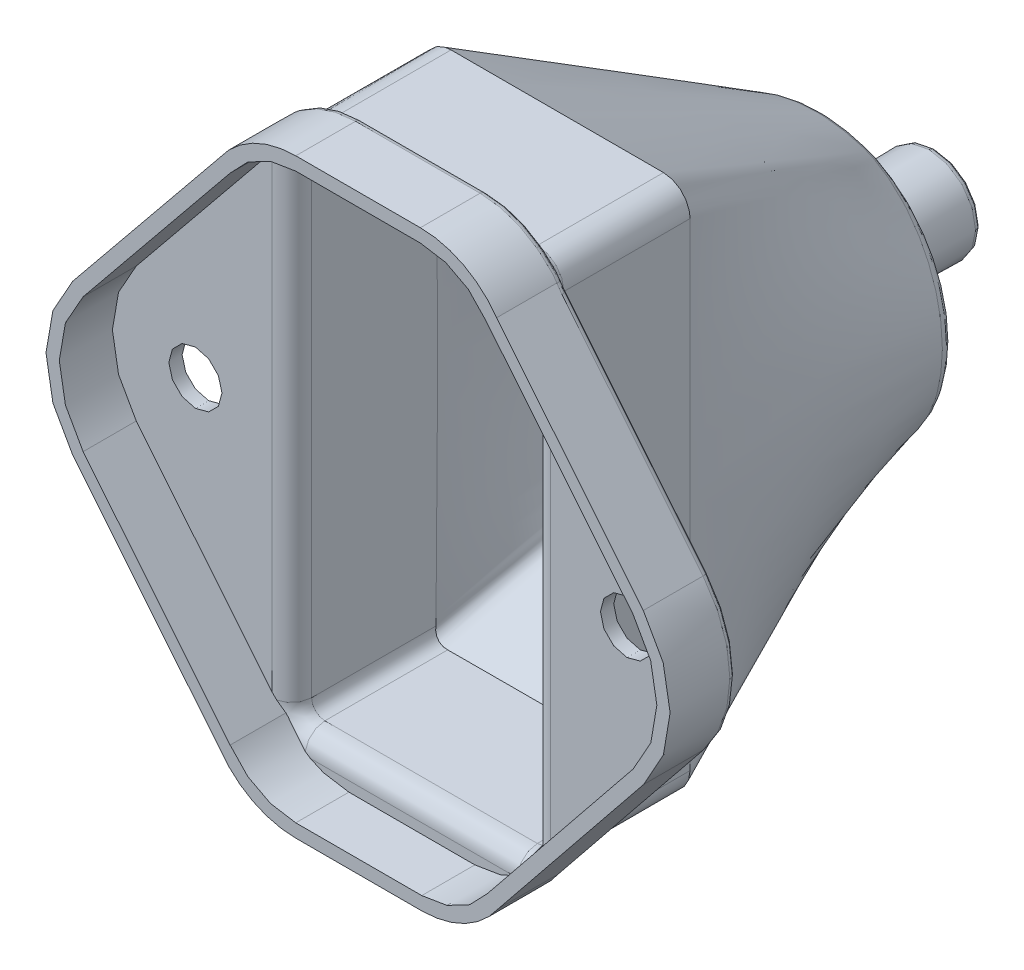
SolidWorks part; units mm, degrees
ref_plane "Plan de face" through (0, 0, 0) normal (0, 0, 1) x (1, 0, 0)
ref_plane "Plan de dessus" through (0, 0, 0) normal (0, 1, 0) x (1, 0, 0)
ref_plane "Plan de droite" through (0, 0, 0) normal (1, 0, 0) x (0, 0, -1)
sketch "Esquisse1" plane through (0, 0, 0) normal (0, 0, 1) x (1, 0, 0)
  line L0 (-69.4038, 0) -> (68.4211, 0) construction
  line L1 (0, 58.9625) -> (0, -57.9798) construction
  line L2 (-9.3809, 44.5) -> (9.3809, 44.5)
  line L3 (21.0814, -38.5) -> (43.0129, -11.2977)
  line L4 (20.87, 38.5) -> (42.9597, 11.3634)
  line L5 (9.5923, -44.5) -> (-9.3809, -44.5)
  line L6 (-20.87, -38.5) -> (-42.9597, -11.3634)
  line L7 (-20.87, 38.5) -> (-42.9597, 11.3634)
  line L8 (47, 0) -> (47, 40.5367) construction
  line L9 (-47, 0) -> (-47, 38.6875) construction
  arc A0 (20.87, 38.5) -> (9.3809, 44.5) centre (9.3809, 30.5) ccw
  arc A1 (-20.87, 38.5) -> (-9.3809, 44.5) centre (-9.3809, 30.5) cw
  arc A2 (-9.3809, -44.5) -> (-20.87, -38.5) centre (-9.3809, -30.5) cw
  arc A3 (21.0814, -38.5) -> (9.5923, -44.5) centre (9.5923, -30.5) cw
  arc A4 (43.0129, -11.2977) -> (42.9597, 11.3634) centre (29, 0) ccw
  arc A5 (-42.9597, 11.3634) -> (-42.9597, -11.3634) centre (-29, 0) ccw
  point P14 (16.934, 45)
  point P17 (-16.934, 45)
  point P20 (-16.934, -45)
  point P23 (16.934, -45)
  dimension "D4" = 14
  dimension "D1" = 36
  dimension "D2" = 36
  dimension "D8" = 6
  dimension "D3" = 89
  dimension "D5" = 94
  dimension "D6" = 47
  dimension "D9" = 6
extrude "Extrusion1" add sketch "Esquisse1" along normal blind 10
sketch "Esquisse5" plane through (0, 0, 10) normal (0, 0, 1) x (1, 0, 0)
  line L0 (-59.0836, 0) -> (58.9228, 0) construction
  line L1 (32.5, 17.2026) -> (32.5, -13.9871) construction
  line L2 (-32.5, 17.2026) -> (-32.5, -12.8617) construction
  line L3 (0, 20.0965) -> (0, -30.3859) construction
  circle A0 centre (-32.5, 0) radius 4
  circle A1 centre (32.5, 0) radius 4
  dimension "D1" = 8
  dimension "D2" = 8
  dimension "D3" = 65
  dimension "D4" = 32.5
sketch "Esquisse6" plane through (0, 0, 0) normal (0, 0, -1) x (-1, 0, 0)
  line L0 (-74.2893, 0) -> (64.1246, 0) construction
  line L1 (0, 58.8259) -> (0, -65.3141) construction
  line L3 (-20, 40) -> (20, 40)
  line L4 (-20, 40) -> (-20, -40)
  line L5 (-20, -40) -> (20, -40)
  line L6 (20, 40) -> (20, -40)
  dimension "D1" = 80
  dimension "D2" = 40
extrude "Extrusion2" add sketch "Esquisse6" along normal blind 20
ref_plane "Plan1" through (0, 0, -60) normal (0, 0, -1) x (-1, 0, 0)
sketch "Esquisse7" plane through (0, 0, -60) normal (0, 0, -1) x (-1, 0, 0)
  line L0 (-20, 40) -> (-20, -40) construction
  line L1 (-20, 40) -> (-20, -40) construction
  circle A0 centre (0, 0) radius 20
fillet "Congé1" radius 4 4 edges at (20, -40, -10) (-20, -40, -10) (-20, 40, -10) (20, 40, -10)
sketch "Esquisse8" plane through (0, 0, -20) normal (0, 0, -1) x (-1, 0, 0)
  line L8 (-20, 36) -> (-20, -36)
  line L9 (-16, -40) -> (16, -40)
  line L10 (20, -36) -> (20, 36)
  line L11 (16, 40) -> (-16, 40)
  line L12 (-20, 36) -> (-20, -36)
  line L13 (-16, -40) -> (16, -40)
  line L14 (20, -36) -> (20, 36)
  line L15 (16, 40) -> (-16, 40)
  arc A4 (-20, -36) -> (-16, -40) centre (-16, -36) ccw
  arc A5 (16, -40) -> (20, -36) centre (16, -36) ccw
  arc A6 (20, 36) -> (16, 40) centre (16, 36) ccw
  arc A7 (-16, 40) -> (-20, 36) centre (-16, 36) ccw
  arc A8 (-20, -36) -> (-16, -40) centre (-16, -36) ccw
  arc A9 (16, -40) -> (20, -36) centre (16, -36) ccw
  arc A10 (20, 36) -> (16, 40) centre (16, 36) ccw
  arc A11 (-16, 40) -> (-20, 36) centre (-16, 36) ccw
  dimension "D1" = 0
loft "Lissage1" add profiles "Esquisse8", "Esquisse7"
sketch "Esquisse9" plane through (0, 0, -60) normal (0, 0, -1) x (-1, 0, 0)
  circle A0 centre (0, 0) radius 10
  dimension "D1" = 20
extrude "Extrusion3" add sketch "Esquisse9" along normal blind 2
sketch "Esquisse10" plane through (0, 0, -62) normal (0, 0, -1) x (-1, 0, 0)
  circle A0 centre (0, 0) radius 7
  dimension "D1" = 14
extrude "Extrusion4" add sketch "Esquisse10" along normal blind 15
fillet "Congé2" radius 1 8 edges at (-18.8284, -38.8284, 0) (0, -40, 0) (18.8284, -38.8284, 0) (20, 0, 0) (18.8284, 38.8284, 0) (0, 40, 0) (-18.8284, 38.8284, 0) (-20, 0, 0)
fillet "Congé3" radius 2 1 edges at (-20, 0, -60)
fillet "Congé4" radius 2 1 edges at (-10, 0, -60)
fillet "Congé6" radius 1 12 edges at (-31.9148, -24.9317, 0) (-47, 0, 0) (-31.9148, 24.9317, 0) (0, 44.5, 0) (-15.8616, 42.9097, 0) (-15.8616, -42.9097, 0) (0.1057, -44.5, 0) (16.073, -42.9097, 0) (32.0472, -24.8989, 0) (47, 0.0423, 0) (31.9148, 24.9317, 0) (15.8616, 42.9097, 0)
shell "Coque2" thickness 2
extrude "Enlèv. mat.-Extru.4" cut sketch "Esquisse5" against normal through all
sketch "Esquisse11" plane through (0, 0, -75) normal (0, 0, 1) x (1, 0, 0)
  circle A0 centre (0, 0) radius 5 construction
  circle A1 centre (0, 0) radius 5
extrude "Enlèv. mat.-Extru.5" cut sketch "Esquisse11" against normal through all
fillet "Congé7" radius 1 1 edges at (-7, 0, -77)
ref_plane "Plan2" through (0, 0, -41.5) normal (0, 0, 1) x (1, 0, 0)
